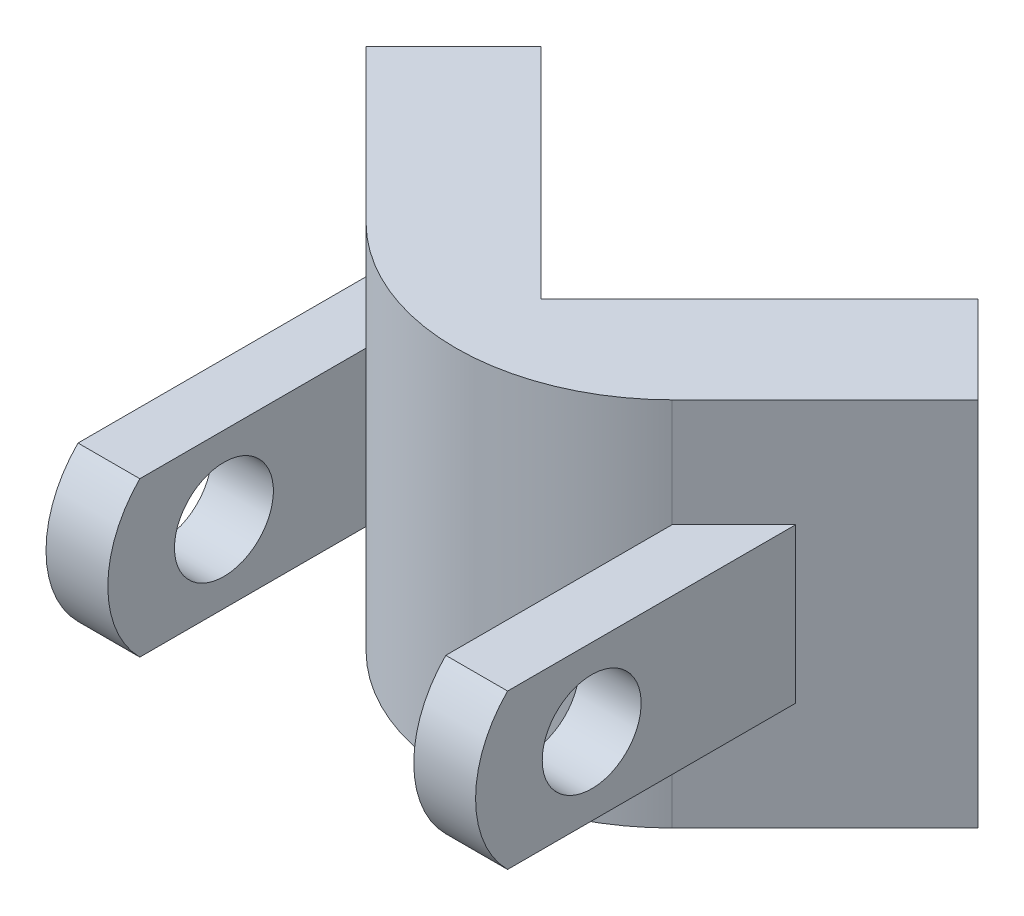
SolidWorks part; units mm, degrees
ref_plane "Front Plane" through (0, 0, 0) normal (0, 0, 1) x (1, 0, 0)
ref_plane "Top Plane" through (0, 0, 0) normal (0, 1, 0) x (1, 0, 0)
ref_plane "Right Plane" through (0, 0, 0) normal (1, 0, 0) x (0, 0, -1)
sketch "Sketch3" plane through (0, 0, 0) normal (0, 1, 0) x (1, 0, 0)
  line L0 (0, 0) -> (17.9605, 17.9605)
  line L1 (0, 0) -> (-17.9605, 17.9605)
  line L2 (17.9605, 17.9605) -> (25.1447, 10.7763)
  line L3 (25.1447, 10.7763) -> (0, -14.3684)
  line L4 (0, -14.3684) -> (-25.1447, 10.7763)
  line L5 (-25.1447, 10.7763) -> (-17.9605, 17.9605)
  dimension "D1" = 35.56
  dimension "D2" = 10.16
  dimension "D3" = 25.4
  dimension "D4" = 25.4
  dimension "D5" = 10.16
  dimension "D6" = 35.56
extrude "Boss-Extrude2" add sketch "Sketch3" along normal mid plane 30.48 contours L1 L5 L4 L3 L2 L0
sketch "Sketch5" plane through (0, 0, 0) normal (0, 1, 0) x (1, 0, 0)
  line L0 (-12.5724, -1.7961) -> (-12.5724, -24.6561)
  line L1 (0, -14.3684) -> (-25.1447, 10.7763) construction
  line L2 (-12.5724, -24.6561) -> (-17.6524, -24.6561)
  line L3 (-17.6524, -24.6561) -> (-17.6524, 3.2839)
  line L4 (-17.6524, 3.2839) -> (-12.5724, -1.7961)
  line L5 (25.1447, 10.7763) -> (0, -14.3684) construction
  point P12 (12.5724, -1.7961)
  dimension "D1" = 5.08
  dimension "D2" = 22.86
  dimension "D3" = 27.94
  dimension "D4" = 25.1447
extrude "Boss-Extrude3" add sketch "Sketch5" along normal mid plane 12.7
sketch "Sketch7" plane through (0, 0, 0) normal (0, 1, 0) x (1, 0, 0)
  line L0 (12.5724, -1.7961) -> (12.5724, -24.6561)
  line L1 (25.1447, 10.7763) -> (0, -14.3684) construction
  line L2 (12.5724, -24.6561) -> (17.6524, -24.6561)
  line L3 (17.6524, -24.6561) -> (17.6524, 4.9185)
  line L4 (17.6524, 4.9185) -> (12.5724, -1.7961)
  dimension "D1" = 22.86
  dimension "D2" = 5.08
extrude "Boss-Extrude5" add sketch "Sketch7" along normal mid plane 12.7 contours L3 L4 L0 L2
sketch "Sketch9" plane through (-17.6524, 0, 0) normal (-1, 0, 0) x (0, 0, 1)
  line L0 (24.6561, 6.35) -> (24.6561, -6.35) construction
  circle A0 centre (13.4801, 0) radius 4.064
  dimension "D1" = 8.128
  dimension "D2" = 11.176
extrude "Cut-Extrude1" cut sketch "Sketch9" against normal through all
sketch "Sketch11" plane through (0, 15.24, 0) normal (0, 1, 0) x (1, 0, 0)
  line L1 (12.5724, -1.7961) -> (12.5724, -14.4897)
  line L2 (12.5724, -1.7961) -> (12.5724, -24.6561) construction
  line L3 (12.5724, -14.4897) -> (-12.5724, -14.4897)
  line L4 (-12.5724, -24.6561) -> (-12.5724, -1.7961) construction
  line L5 (-12.5724, -14.4897) -> (-12.5724, -1.7961)
  arc A0 (-12.5724, -1.7961) -> (12.5724, -1.7961) centre (0, 10.7921) ccw
extrude "Cut-Extrude4" cut sketch "Sketch11" against normal through all contours A0 L1 L3 L5
sketch "Sketch14" plane through (-17.6524, 0, 0) normal (-1, 0, 0) x (0, 0, 1)
  line L0 (-3.2839, 6.35) -> (24.6561, 6.35) construction
  line L1 (-3.2839, -6.35) -> (24.6561, -6.35) construction
  line L2 (20.3918, 6.35) -> (24.6561, 6.35)
  line L3 (24.6561, 6.35) -> (24.6561, -6.35)
  line L4 (24.6561, -6.35) -> (20.3918, -6.35)
  arc A0 (20.3918, 6.35) -> (20.3918, -6.35) centre (14.0418, 0) cw
extrude "Cut-Extrude7" cut sketch "Sketch14" against normal through all
